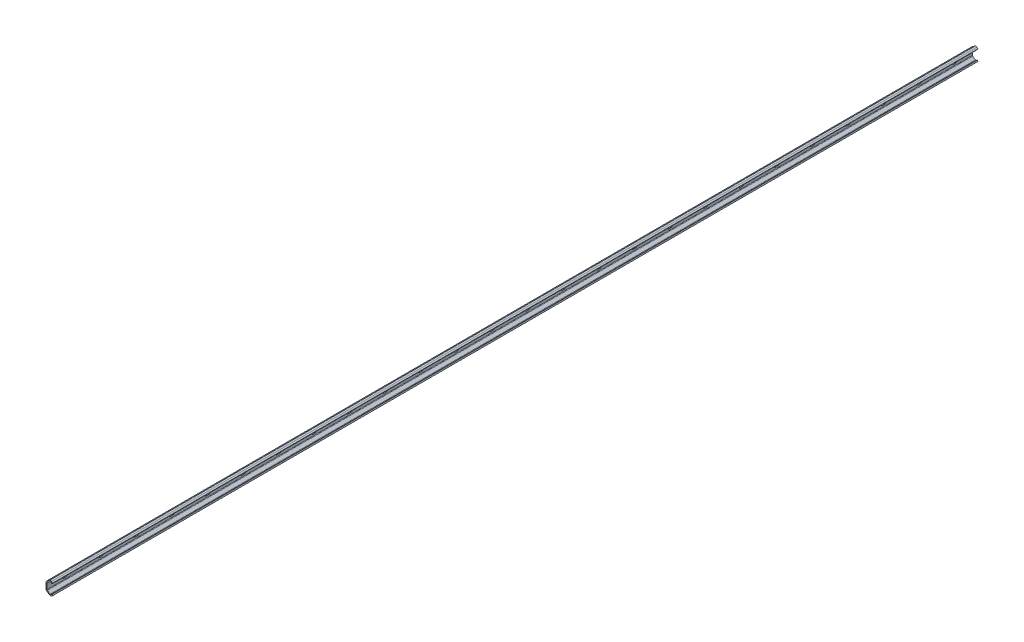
SolidWorks part; units mm, degrees
ref_plane "Front Plane" through (0, 0, 0) normal (0, 0, 1) x (1, 0, 0)
ref_plane "Top Plane" through (0, 0, 0) normal (0, 1, 0) x (1, 0, 0)
ref_plane "Right Plane" through (0, 0, 0) normal (1, 0, 0) x (0, 0, -1)
sketch "Sketch1" plane through (0, 0, 0) normal (0, 0, 1) x (1, 0, 0)
  line L0 (13.5661, -10.1611) -> (15, -12.209)
  line L1 (15, -12.209) -> (12.159, -14.1983)
  line L2 (7.841, -14.1983) -> (2.0723, -10.159)
  line L3 (0, -6.37) -> (0, 6.37)
  line L4 (2.0723, 10.159) -> (7.841, 14.1983)
  line L5 (12.159, 14.1983) -> (15, 12.209)
  line L6 (15, 12.209) -> (13.5661, 10.1611)
  line L7 (13.5661, 10.1611) -> (10.861, 12.0552)
  line L8 (9.139, 12.0552) -> (3.2542, 7.9346)
  line L9 (2.5, 6.37) -> (2.5, -6.37)
  line L10 (3.2542, -7.9346) -> (9.139, -12.0552)
  line L11 (10.861, -12.0552) -> (13.5661, -10.1611)
  arc A0 (12.159, -14.1983) -> (7.841, -14.1983) centre (10, -11.1149) cw
  arc A1 (2.0723, -10.159) -> (0, -6.37) centre (4.8653, -6.1702) cw
  arc A2 (0, 6.37) -> (2.0723, 10.159) centre (4.5, 6.37) cw
  arc A3 (7.841, 14.1983) -> (12.159, 14.1983) centre (10, 11.1149) cw
  arc A4 (10.861, 12.0552) -> (9.139, 12.0552) centre (10, 10.8255) ccw
  arc A5 (3.2542, 7.9346) -> (2.5, 6.37) centre (4.2732, 6.4793) ccw
  arc A6 (2.5, -6.37) -> (3.2542, -7.9346) centre (4.5, -6.37) ccw
  arc A7 (9.139, -12.0552) -> (10.861, -12.0552) centre (10, -10.8255) ccw
  dimension "D1" = 3.7641
  dimension "D2" = 4.8694
  dimension "D3" = 4.5
  dimension "D4" = 3.7641
  dimension "D5" = 1.5011
  dimension "D6" = 1.7766
  dimension "D7" = 2
  dimension "D8" = 1.5011
  dimension "D9" = 2.0723
  dimension "D10" = 2.0723
  dimension "D11" = 2.5
  dimension "D12" = 3.2542
  dimension "D13" = 3.2542
  dimension "D14" = 4.2732
  dimension "D15" = 4.8653
  dimension "D16" = 7.841
  dimension "D17" = 7.841
  dimension "D18" = 4.5
  dimension "D19" = 9.139
  dimension "D20" = 10
  dimension "D21" = 10.861
  dimension "D22" = 6.37
  dimension "D23" = 9.139
  dimension "D24" = 6.1702
  dimension "D27" = 10.861
  dimension "D31" = 13.5661
  dimension "D32" = 13.5661
  dimension "D33" = 15
  dimension "D34" = 15
extrude "Extrude1" add sketch "Sketch1" against normal blind 2080
sketch "Sketch3" plane through (2.5, 0, 0) normal (1, 0, 0) x (0, 0, -1)
  line L0 (37.5, 0) -> (42.5, 0) construction
  line L1 (37.5, 3) -> (42.5, 3)
  line L2 (37.5, -3) -> (42.5, -3)
  arc A0 (37.5, 3) -> (37.5, -3) centre (37.5, 0) ccw
  arc A1 (42.5, 3) -> (42.5, -3) centre (42.5, 0) cw
  point P5 (40, 0)
  dimension "D1" = 5
  dimension "D2" = 6
  dimension "D3" = 40
extrude "Extrude2" cut sketch "Sketch3" against normal through all
pattern_linear "LPattern1" count 26 spacing 80 along (0, 0, -1) of "Extrude2"
